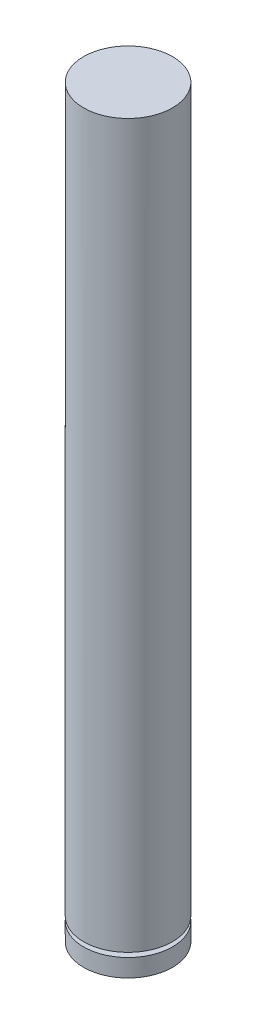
SolidWorks part; units mm, degrees
ref_plane "Front Plane" through (0, 0, 0) normal (0, 0, 1) x (1, 0, 0)
ref_plane "Top Plane" through (0, 0, 0) normal (0, 1, 0) x (1, 0, 0)
ref_plane "Right Plane" through (0, 0, 0) normal (1, 0, 0) x (0, 0, -1)
sketch "Sketch1" plane through (0, 0, 0) normal (0, 1, 0) x (1, 0, 0)
  circle A0 centre (0, 0) radius 2
  dimension "D1" = 4
extrude "Boss-Extrude1" add sketch "Sketch1" along normal blind 33.5
sketch "Sketch2" plane through (0, 0, 0) normal (0, 0, 1) x (1, 0, 0)
  line L0 (-2, 0) -> (-2, 33.5)
  line L1 (2, 33.5) -> (2, 0)
  line L2 (2, 33.5) -> (2, 0)
  line L3 (-2, 0) -> (-2, 33.5)
  line L4 (-2, 0) -> (2, 0) construction
  line L5 (2, 0.8) -> (1.5, 0.8)
  line L6 (2, 0.8) -> (2, 1)
  line L7 (2, 1) -> (1.5, 1)
  line L8 (1.5, 0.8) -> (1.5, 1)
  dimension "D1" = 0.2
  dimension "D2" = 0.5
  dimension "D3" = 0.8
ref_axis "Axis1" through (0, -1.7, 0) along (0, 1, 0)
revolve "Cut-Revolve1" cut sketch "Sketch2" angle 360 about axis through (0, -1.7, 0) along (0, 1, 0)
